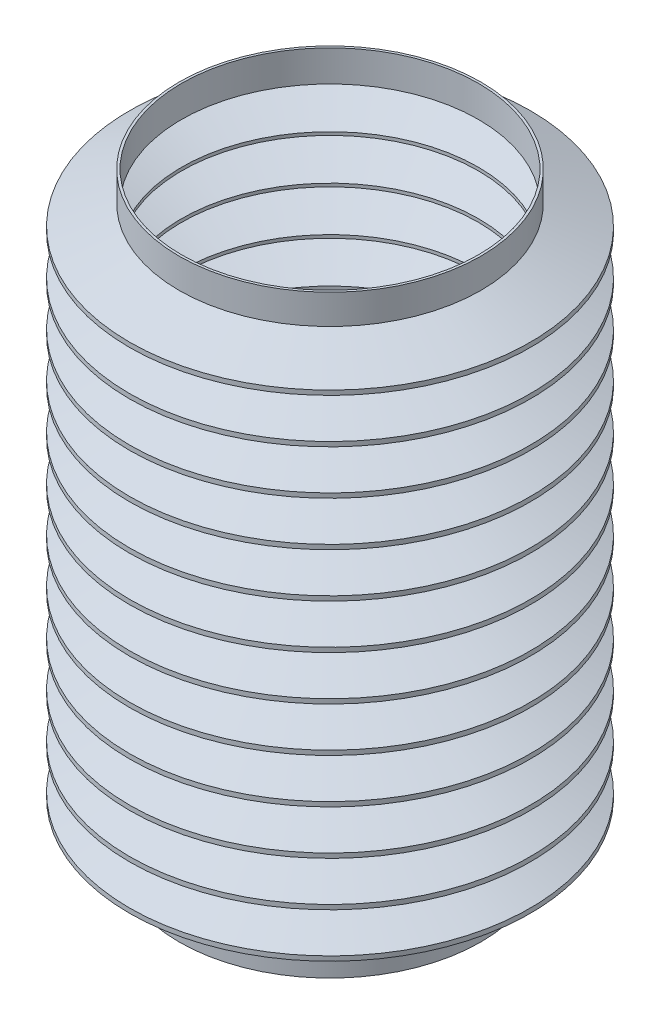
SolidWorks part; units mm, degrees
ref_plane "Front Plane" through (0, 0, 0) normal (0, 0, 1) x (1, 0, 0)
ref_plane "Top Plane" through (0, 0, 0) normal (0, 1, 0) x (1, 0, 0)
ref_plane "Right Plane" through (0, 0, 0) normal (1, 0, 0) x (0, 0, -1)
sketch "Sketch1" plane through (0, 0, 0) normal (0, 0, 1) x (1, 0, 0)
  line L0 (0, 0) -> (0, 92.7377) construction
  line L1 (-64.516, 0) -> (-63.5, 0)
  line L2 (-64.516, 101.6) -> (-38.5279, 101.6) construction
  line L3 (-85.4652, 168.275) -> (-109.151, 168.275) construction
  line L4 (-64.516, 0) -> (-64.516, 25.4)
  line L5 (-64.516, 25.4) -> (-85.725, 33.9344)
  line L6 (-63.5, 26.0863) -> (-63.5, 0)
  line L7 (-63.5, 26.0863) -> (-85.4652, 34.925)
  line L8 (-63.5, 43.7637) -> (-85.4652, 34.925)
  line L9 (-64.516, 44.45) -> (-85.725, 35.9156)
  line L10 (-64.516, 44.45) -> (-110.3883, 44.45) construction
  line L11 (-85.725, 52.9844) -> (-85.725, 54.9656)
  line L12 (-64.516, 63.5) -> (-85.725, 54.9656)
  line L13 (-63.5, 62.8137) -> (-85.4652, 53.975)
  line L14 (-85.4652, 53.975) -> (-109.151, 53.975) construction
  line L15 (-63.5, 45.1363) -> (-85.4652, 53.975)
  line L16 (-64.516, 44.45) -> (-85.725, 52.9844)
  line L17 (-64.516, 63.5) -> (-96.1927, 63.5) construction
  line L18 (-85.725, 35.9156) -> (-85.725, 33.9344)
  line L19 (-63.5, 81.8637) -> (-63.5, 83.2363)
  line L20 (-85.725, 74.0156) -> (-85.725, 72.0344)
  line L21 (-64.516, 82.55) -> (-85.725, 74.0156)
  line L22 (-63.5, 81.8637) -> (-85.4652, 73.025)
  line L23 (-63.5, 64.1863) -> (-85.4652, 73.025)
  line L24 (-64.516, 63.5) -> (-85.725, 72.0344)
  line L25 (-63.5, 45.1363) -> (-63.5, 43.7637)
  line L26 (-64.516, 82.55) -> (-96.0474, 82.55) construction
  line L27 (-64.516, 120.65) -> (-96.0474, 120.65) construction
  line L28 (-64.516, 139.7) -> (-96.1927, 139.7) construction
  line L29 (-85.4652, 149.225) -> (-109.151, 149.225) construction
  line L31 (-63.5, 100.9137) -> (-85.4652, 92.075)
  line L32 (-85.4652, 34.925) -> (-109.151, 34.925) construction
  line L33 (-63.5, 83.2363) -> (-85.4652, 92.075)
  line L34 (-85.725, 91.0844) -> (-85.725, 93.0656)
  line L35 (-64.516, 101.6) -> (-85.725, 93.0656)
  line L36 (-64.516, 82.55) -> (-85.725, 91.0844)
  line L37 (-63.5, 64.1863) -> (-63.5, 62.8137)
  line L38 (-64.516, 158.75) -> (-110.3883, 158.75) construction
  line L39 (-63.5, 139.0137) -> (-63.5, 140.3863)
  line L40 (-64.516, 120.65) -> (-85.725, 112.1156)
  line L41 (-64.516, 101.6) -> (-85.725, 110.1344)
  line L42 (-85.725, 112.1156) -> (-85.725, 110.1344)
  line L43 (-63.5, 119.9637) -> (-85.4652, 111.125)
  line L44 (-63.5, 102.2863) -> (-85.4652, 111.125)
  line L45 (-63.5, 158.0637) -> (-63.5, 159.4363)
  line L46 (-64.516, 139.7) -> (-85.725, 131.1656)
  line L47 (-63.5, 139.0137) -> (-85.4652, 130.175)
  line L48 (-63.5, 121.3363) -> (-85.4652, 130.175)
  line L49 (-64.516, 120.65) -> (-85.725, 129.1844)
  line L50 (-85.725, 129.1844) -> (-85.725, 131.1656)
  line L51 (-63.5, 121.3363) -> (-63.5, 119.9637)
  line L52 (-85.725, 167.2844) -> (-85.725, 169.2656)
  line L53 (-64.516, 158.75) -> (-85.725, 150.2156)
  line L54 (-63.5, 158.0637) -> (-85.4652, 149.225)
  line L55 (-63.5, 140.3863) -> (-85.4652, 149.225)
  line L56 (-64.516, 139.7) -> (-85.725, 148.2344)
  line L57 (-85.725, 150.2156) -> (-85.725, 148.2344)
  line L58 (-64.516, 158.75) -> (-85.725, 167.2844)
  line L59 (-63.5, 159.4363) -> (-85.4652, 168.275)
  line L60 (-63.5, 177.1137) -> (-85.4652, 168.275)
  line L61 (-64.516, 177.8) -> (-85.725, 169.2656)
  line L62 (-64.516, 177.8) -> (-50.6607, 177.8) construction
  line L63 (-64.516, 196.85) -> (-110.3883, 196.85) construction
  line L64 (-85.4652, 206.375) -> (-109.151, 206.375) construction
  line L65 (-64.516, 215.9) -> (-96.1927, 215.9) construction
  line L66 (-64.516, 234.95) -> (-96.0474, 234.95) construction
  line L67 (-85.4652, 187.325) -> (-109.151, 187.325) construction
  line L68 (-64.516, 177.8) -> (-85.725, 186.3344)
  line L69 (-63.5, 178.4863) -> (-85.4652, 187.325)
  line L70 (-63.5, 196.1637) -> (-85.4652, 187.325)
  line L71 (-64.516, 196.85) -> (-85.725, 188.3156)
  line L72 (-85.725, 205.3844) -> (-85.725, 207.3656)
  line L73 (-64.516, 215.9) -> (-85.725, 207.3656)
  line L74 (-63.5, 215.2137) -> (-85.4652, 206.375)
  line L75 (-63.5, 197.5363) -> (-85.4652, 206.375)
  line L76 (-64.516, 196.85) -> (-85.725, 205.3844)
  line L77 (-85.725, 188.3156) -> (-85.725, 186.3344)
  line L78 (-63.5, 234.2637) -> (-63.5, 235.6363)
  line L79 (-85.725, 226.4156) -> (-85.725, 224.4344)
  line L80 (-64.516, 234.95) -> (-85.725, 226.4156)
  line L81 (-63.5, 234.2637) -> (-85.4652, 225.425)
  line L82 (-63.5, 216.5863) -> (-85.4652, 225.425)
  line L83 (-64.516, 215.9) -> (-85.725, 224.4344)
  line L84 (-63.5, 197.5363) -> (-63.5, 196.1637)
  line L85 (-63.5, 253.3137) -> (-85.4652, 244.475)
  line L86 (-63.5, 235.6363) -> (-85.4652, 244.475)
  line L87 (-85.725, 243.4844) -> (-85.725, 245.4656)
  line L88 (-64.516, 254) -> (-85.725, 245.4656)
  line L89 (-64.516, 234.95) -> (-85.725, 243.4844)
  line L90 (-63.5, 216.5863) -> (-63.5, 215.2137)
  line L91 (-63.5, 178.4863) -> (-63.5, 177.1137)
  line L92 (-63.5, 102.2863) -> (-63.5, 100.9137)
  line L93 (-64.516, 254) -> (-64.516, 279.4)
  line L94 (-64.516, 279.4) -> (-63.5, 279.4)
  line L95 (-63.5, 279.4) -> (-63.5, 253.3137)
  dimension "D2" = 127
  dimension "D3" = 1.016
  dimension "D4" = 25.4
  dimension "D5" = 171.45
  dimension "D6" = 1.016
  dimension "D7" = 228.6
  dimension "D8" = 1.016
  dimension "D9" = 25.4
  dimension "D14" = 1.9812
revolve "Revolve1" add sketch "Sketch1" angle 360 about L0
sketch "Sketch10" [suppressed] plane through (0, 0, 0) normal (0, 0, 1) x (1, 0, 0)
  line L28 (-120, 72.7819) -> (-149.7538, 62.25)
  line L29 (-120, 74.2181) -> (-120, 72.7819)
  line L30 (-149.7538, 84.75) -> (-120, 74.2181)
  line L31 (-120, 95.2819) -> (-149.7538, 84.75)
  line L32 (-120, 102) -> (-120, 95.2819)
  line L33 (-120, 72.7819) -> (-149.7538, 62.25)
  line L34 (-120, 74.2181) -> (-120, 72.7819)
  line L35 (-149.7538, 84.75) -> (-120, 74.2181)
  line L36 (-120, 95.2819) -> (-149.7538, 84.75)
  line L37 (-120, 102) -> (-120, 95.2819)
  line L62 (-120, 29.2181) -> (-120, 27.7819)
  line L63 (-149.7538, 39.75) -> (-120, 29.2181)
  line L64 (-120, 50.2819) -> (-149.7538, 39.75)
  line L65 (-120, 51.7181) -> (-120, 50.2819)
  line L66 (-149.7538, 62.25) -> (-120, 51.7181)
  line L67 (-120, 29.2181) -> (-120, 27.7819)
  line L68 (-149.7538, 39.75) -> (-120, 29.2181)
  line L69 (-120, 50.2819) -> (-149.7538, 39.75)
  line L70 (-120, 51.7181) -> (-120, 50.2819)
  line L71 (-149.7538, 62.25) -> (-120, 51.7181)
  line L72 (-149.7538, 17.25) -> (-120, 6.7181)
  line L73 (-120, 27.7819) -> (-149.7538, 17.25)
  line L74 (-149.7538, 17.25) -> (-120, 6.7181)
  line L75 (-120, 27.7819) -> (-149.7538, 17.25)
  line L76 (-120, 0) -> (0, 0)
  line L77 (-120, 6.7181) -> (-120, 0)
  line L78 (-120, 6.7181) -> (-120, 0)
  line L79 (-150, 0) -> (150, 0) construction
  line L80 (0, 0) -> (0, 102)
  line L81 (150, 102) -> (-150, 102) construction
  line L82 (0, 102) -> (-120, 102)
  line L83 (0, 1.016) -> (0, 155.4378) construction
  line L84 (150, 1.016) -> (-150, 1.016) construction
  dimension "D1" = 0
  dimension "D2" = 0
  dimension "D3" = 0
  dimension "D4" = 0
sketch "Sketch11" plane through (0, 0, 0) normal (0, 0, 1) x (1, 0, 0)
  line L0 (64.516, 279.4) -> (-64.516, 279.4) construction
  line L1 (0, 279.4) -> (-64.516, 279.4)
  line L2 (0, 279.4) -> (0, 266.7)
  line L3 (0, 266.7) -> (-64.516, 266.7)
  line L4 (-64.516, 279.4) -> (-64.516, 266.7)
  line L5 (-64.516, 279.4) -> (-64.516, 254) construction
  line L6 (0, 0) -> (-64.516, 0)
  line L7 (0, 0) -> (0, 12.7)
  line L8 (0, 12.7) -> (-64.516, 12.7)
  line L9 (-64.516, 0) -> (-64.516, 12.7)
  line L10 (0, 4.1499) -> (0, 124.9911) construction
  line L11 (0, 279.4) -> (0, 254) construction
  line L12 (0, 26.0863) -> (0, 0) construction
  dimension "D1" = 12.7
  dimension "D2" = 12.7
revolve "Cut-Revolve1" cut sketch "Sketch11" angle 360 about L10
